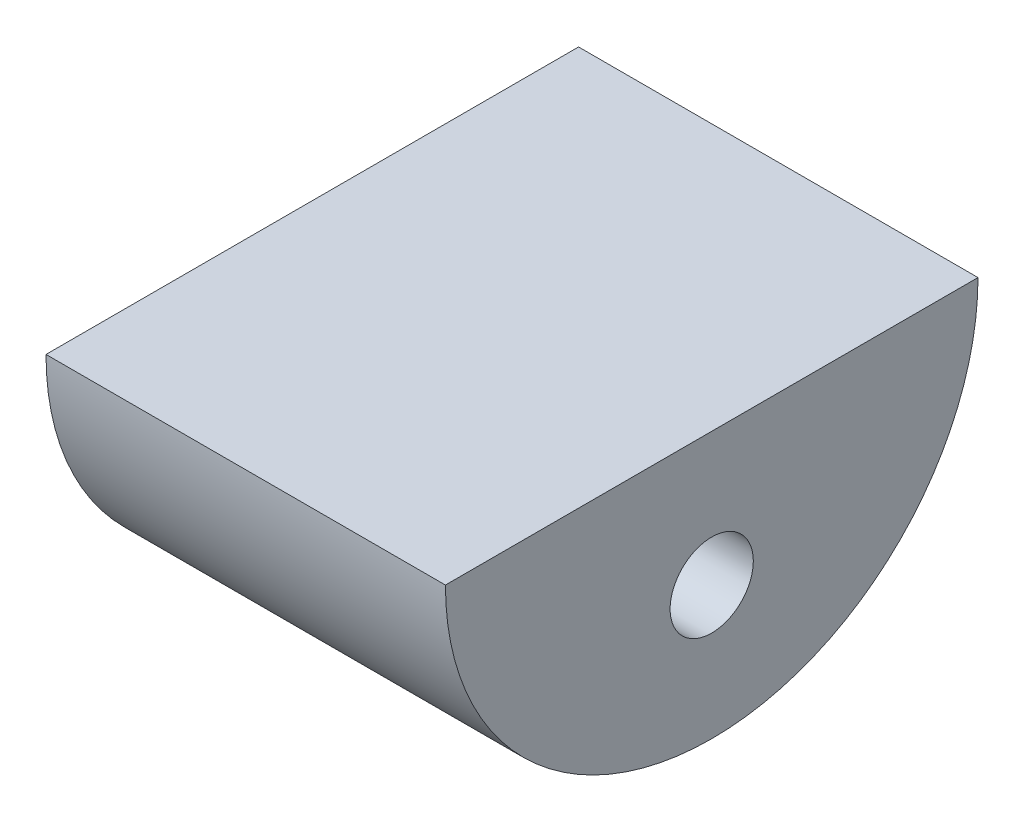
SolidWorks part; units mm, degrees
ref_plane "Front Plane" through (0, 0, 0) normal (0, 0, 1) x (1, 0, 0)
ref_plane "Top Plane" through (0, 0, 0) normal (0, 1, 0) x (1, 0, 0)
ref_plane "Right Plane" through (0, 0, 0) normal (1, 0, 0) x (0, 0, -1)
sketch "Sketch1" plane through (0, 0, 0) normal (1, 0, 0) x (0, 0, -1)
  line L0 (0, -40) -> (0, 40) construction
  line L1 (80, 40) -> (-80, 40)
  circle A0 centre (0, 0) radius 12.5 construction
  circle A1 centre (0, 0) radius 25 construction
  arc A2 (-80, 40) -> (80, 40) centre (0, 40) ccw
  point P6 (0, 0)
  point P11 (0, 40)
  dimension "D1" = 25
  dimension "D2" = 50
  dimension "D3" = 80
extrude "Boss-Extrude1" add sketch "Sketch1" against normal blind 120 contours A2 L1
sketch "Sketch2" plane through (0, 0, 0) normal (1, 0, 0) x (0, 0, -1)
  circle A0 centre (0, 0) radius 12.5
  dimension "D1" = 25
extrude "Cut-Extrude1" cut sketch "Sketch2" against normal blind 20
